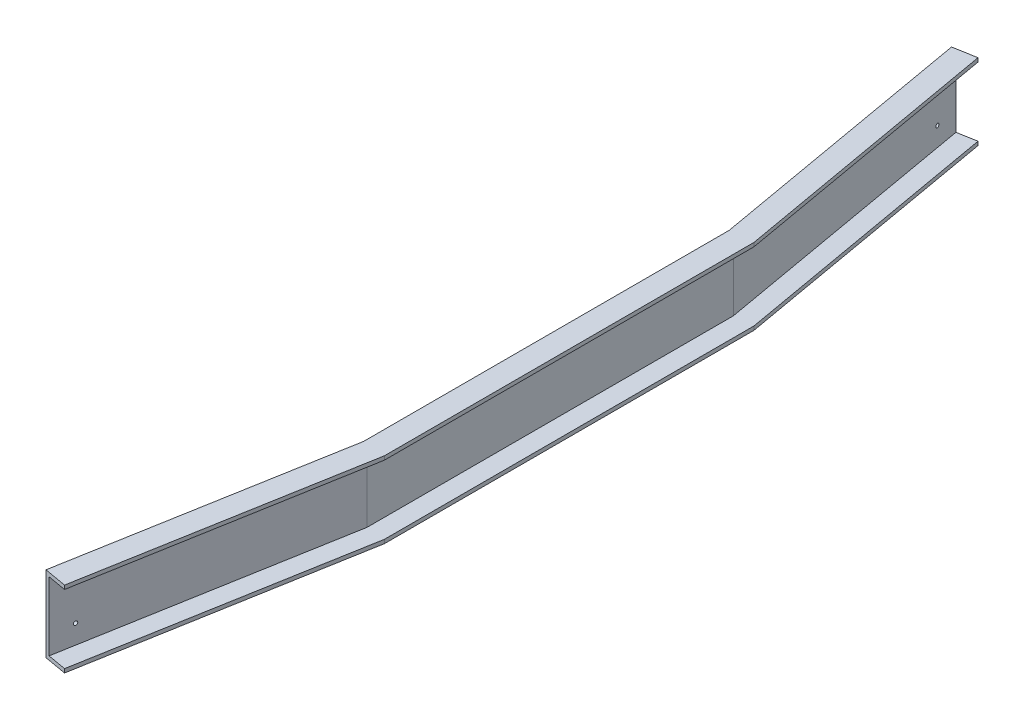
SolidWorks part; units mm, degrees
ref_plane "XY" through (0, 0, 0) normal (0, 0, 1) x (1, 0, 0)
ref_plane "XZ" through (0, 0, 0) normal (0, 1, 0) x (1, 0, 0)
ref_plane "YZ" through (0, 0, 0) normal (1, 0, 0) x (0, 0, -1)
sketch "Sketch1" plane through (0, 0, 0) normal (0, 0, 1) x (1, 0, 0)
  line L0 (0, 0) -> (0, -254)
  line L1 (0, -254) -> (76.2, -254)
  line L2 (0, 0) -> (76.2, 0)
  line L3 (76.2, 0) -> (76.2, -12.7)
  line L4 (76.2, -12.7) -> (12.7, -12.7)
  line L5 (12.7, -12.7) -> (12.7, -241.3)
  line L6 (12.7, -241.3) -> (76.2, -241.3)
  line L7 (76.2, -241.3) -> (76.2, -254)
  dimension "D1" = 76.2
  dimension "D2" = 254
  dimension "D3" = 12.7
  dimension "D4" = 12.7
  dimension "D5" = 12.7
sketch "Sketch2" plane through (0, 0, 0) normal (0, 1, 0) x (1, 0, 0)
  line L0 (0, 0) -> (0, -609.6)
  line L1 (0, -609.6) -> (-158.7839, -1510.1082)
  dimension "D1" = 190
  dimension "D2" = 609.6
  dimension "D3" = 914.4
sweep "Base-Sweep" add profiles "Sketch1" path "Sketch2"
sketch "Sketch3" plane through (104.2477, 0, 18.3817) normal (-0.9848, 0, -0.1736) x (-0.1736, 0, 0.9848)
  circle A0 centre (1438.5388, -50.8) radius 6.35
  circle A1 centre (1438.5388, -177.8) radius 6.35
  circle A2 centre (678.0435, -50.8) radius 6.35
  dimension "D1" = 12.7
  dimension "D2" = 760.4953
  dimension "D3" = 127
  dimension "D4" = 50.8
  dimension "D5" = 76.2
extrude "Cut-Extrude1" cut sketch "Sketch3" against normal through all
mirror "Mirror1"
